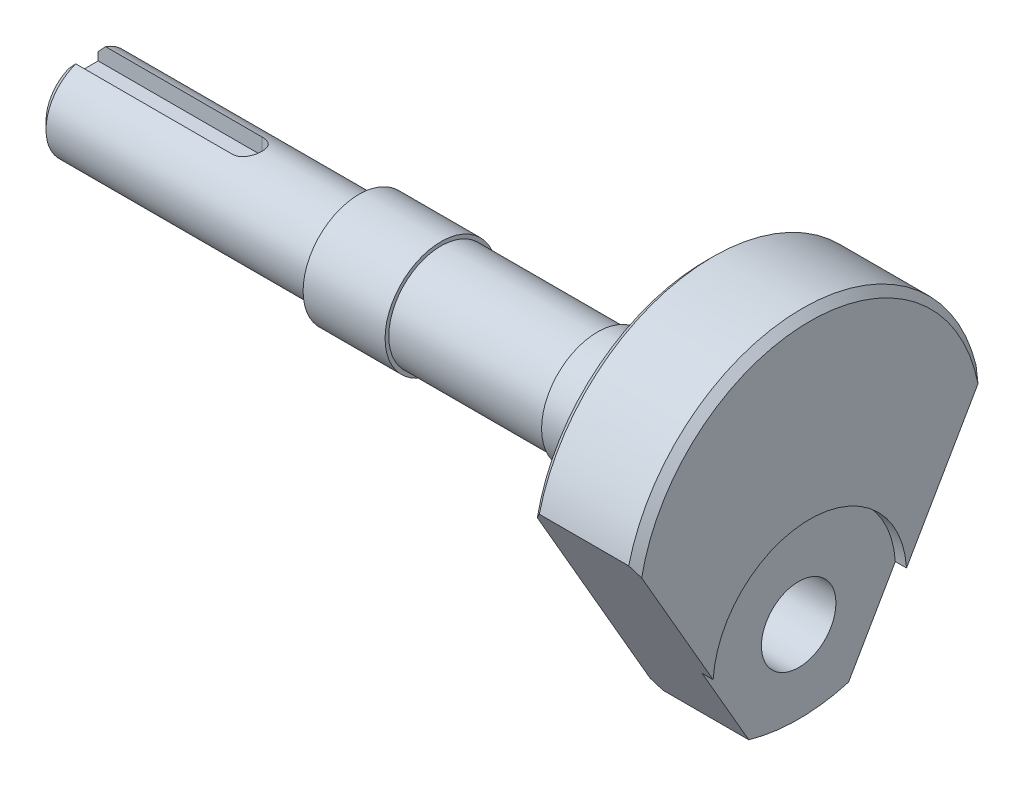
SolidWorks part; units mm, degrees
ref_plane "face" through (0, 0, 0) normal (0, 0, 1) x (1, 0, 0)
ref_plane "dessus" through (0, 0, 0) normal (0, 1, 0) x (1, 0, 0)
ref_plane "profil" through (0, 0, 0) normal (1, 0, 0) x (0, 0, -1)
sketch "Esquisse1" plane through (0, 0, 0) normal (0, 0, 1) x (1, 0, 0)
  line L0 (0, 0) -> (0, 6)
  line L1 (0, 6) -> (37, 6)
  line L2 (37, 6) -> (37, 7.5)
  line L3 (37, 7.5) -> (48, 7.5)
  line L4 (48, 7.5) -> (48, 7)
  line L5 (0, 0) -> (141.7671, 0) construction
  line L6 (48, 7) -> (69, 7)
  line L7 (69, 7) -> (69, 7.5)
  line L8 (69, 7.5) -> (80, 7.5)
  line L9 (80, 7.5) -> (80, 9.5)
  line L10 (97.5, 24) -> (97.5, 0)
  line L11 (83.5, 11.5) -> (83.5, 24)
  line L12 (83.5, 24) -> (97.5, 24)
  line L13 (97.5, 0) -> (0, 0)
  arc A0 (83.5, 11.5) -> (80, 9.5) centre (77.9089, 17.2219) cw
  dimension "D12" = 3.5
  dimension "D10" = 8
  dimension "D1" = 6
  dimension "D2" = 37
  dimension "D3" = 7.5
  dimension "D4" = 11
  dimension "D5" = 7
  dimension "D6" = 21
  dimension "D7" = 11
  dimension "D8" = 7.5
  dimension "D9" = 9.5
  dimension "D11" = 11.5
  dimension "D13" = 24
  dimension "D14" = 14
revolve "Base-Révolution" add sketch "Esquisse1" angle 360 about L5
chamfer "Chanfrein1" distance 1 angle 45
chamfer "Chanfrein2" distance 1 angle 45
sketch "Esquisse2" plane through (97.5, 0, 0) normal (1, 0, 0) x (0, 0, -1)
  line L1 (6.5931, -23.2215) -> (23.3066, 5.7272)
extrude "Enlèv. mat.-Extru.2" cut sketch "Esquisse2" against normal through all and the other way through all flip side to cut
mirror "Symétrie1" about plane through (0, 0, 0) normal (0, 0, 1)
sketch "Esquisse3" plane through (97.5, 0, 0) normal (1, 0, 0) x (0, 0, -1)
  circle A0 centre (0, -13) radius 13
  dimension "D2" = 26
  dimension "D1" = 13
extrude "Enlèv. mat.-Extru.3" cut sketch "Esquisse3" against normal blind 1.5
sketch "Esquisse4" plane through (96, 0, 0) normal (1, 0, 0) x (0, 0, -1)
  circle A0 centre (0, -13) radius 5
  dimension "D1" = 10
extrude "Enlèv. mat.-Extru.4" cut sketch "Esquisse4" against normal through all
sketch "Esquisse5" plane through (0, 0, 0) normal (-1, 0, 0) x (0, 0, 1)
  line L1 (-2, 7.2764) -> (2, 7.2764)
  line L2 (-2, 7.2764) -> (-2, 3.5)
  line L3 (-2, 3.5) -> (2, 3.5)
  line L4 (2, 7.2764) -> (2, 3.5)
  dimension "D1" = 4
  dimension "D2" = 2
  dimension "D3" = 3.5
extrude "Enlèv. mat.-Extru.5" cut sketch "Esquisse5" against normal blind 22
sketch "Esquisse18" plane through (0, 3.5, 0) normal (0, 1, 0) x (-1, 0, 0)
  line L1 (-96, 0) -> (-97.5, 0) construction
  line L2 (0, -2) -> (0, 2) construction
  circle A0 centre (-22, 0) radius 2
  dimension "D1" = 22
  dimension "D2" = 4
extrude "Enlèv. mat.-Extru.6" cut sketch "Esquisse18" along normal through all
hole_wizard "Perçage5" positions "Esquisse17" profile "Esquisse16" tap size "M4x0.7" standard "Ansi Métrique"
sketch "Esquisse17" plane through (0, 0, 0) normal (-1, 0, 0) x (0, 0, 1)
  point P0 (0, 0)
sketch "Esquisse16" plane through (0, 0, 0) normal (0, 1, 0) x (0, 0, 1)
  line L0 (0, 0) -> (0, 16.4914)
  line L1 (0, 16.4914) -> (1.65, 15.5)
  line L2 (1.65, 15.5) -> (1.65, 0)
  line L5 (1.65, 0) -> (0, 0)
  line L10 (0, 16.4914) -> (-1.65, 15.5) construction
  line L11 (0, -6.35) -> (0, 107.95) construction
  dimension "Diamètre du perçage" = 3.3
  dimension "Profondeur du perçage" = 15.5
  dimension "Angle de pointe" = 118
